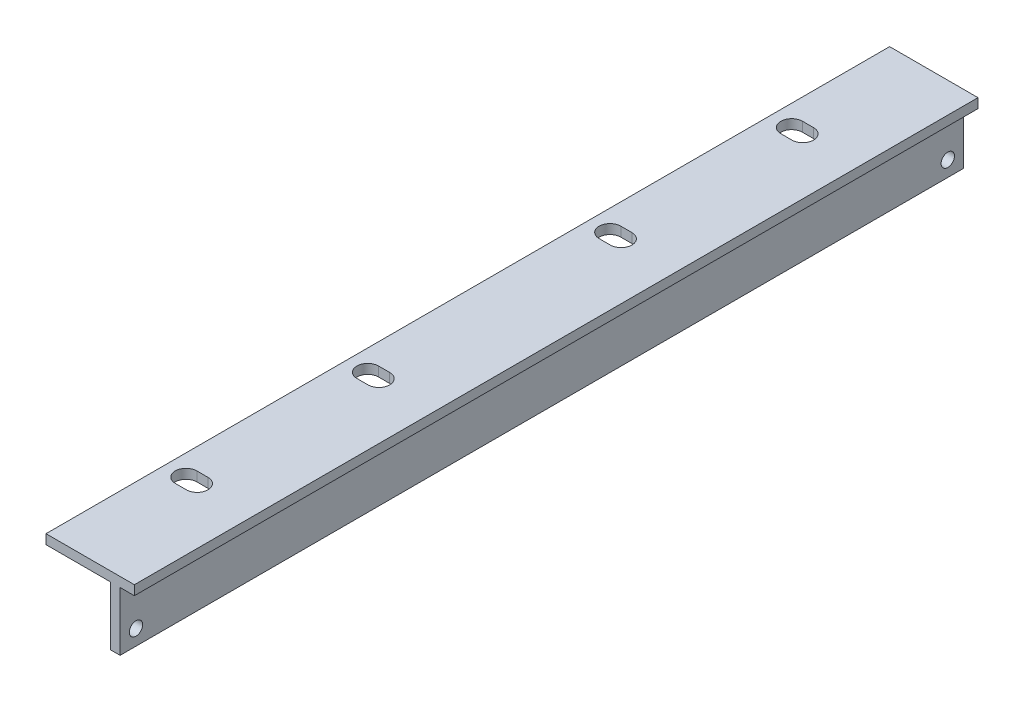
SolidWorks part; units mm, degrees
ref_plane "前视基准面" through (0, 0, 0) normal (0, 0, 1) x (1, 0, 0)
ref_plane "上视基准面" through (0, 0, 0) normal (0, 1, 0) x (1, 0, 0)
ref_plane "右视基准面" through (0, 0, 0) normal (1, 0, 0) x (0, 0, -1)
imported_body "输入1"
sketch "草图1" plane through (0, 0, 0) normal (0, 0, 1) x (1, 0, 0)
  line L0 (-24.8, 0) -> (-27.8, 0)
  line L1 (-27.8, 0) -> (-27.8, -3)
  line L2 (-27.8, -3) -> (-24.8, -3)
  line L8 (-24.8, 0) -> (-24.8, -3)
  line L9 (-24.8, -3) -> (-7.5, -3)
  line L10 (-7.5, -3) -> (-7.5, -21.5)
  line L11 (-7.5, -21.5) -> (-4.5, -21.5)
  line L12 (-4.5, -21.5) -> (-4.5, -3)
  line L13 (-4.5, -3) -> (0, -3)
  line L14 (0, -3) -> (0, 0)
  line L15 (0, 0) -> (-24.8, 0)
  line L17 (-24.8, -3) -> (-7.5, -3)
  line L18 (-7.5, -3) -> (-7.5, -21.5)
  line L19 (-7.5, -21.5) -> (-4.5, -21.5)
  line L20 (-4.5, -21.5) -> (-4.5, -3)
  line L21 (-4.5, -3) -> (0, -3)
  line L22 (0, -3) -> (0, 0)
  line L23 (0, 0) -> (-24.8, 0)
  dimension "D1" = 0
extrude "凸台-拉伸1" add sketch "草图1" along normal blind 265.35
sketch "草图2" plane through (0, 0, 0) normal (0, 1, 0) x (1, 0, 0)
  line L0 (-21.18, -94.575) -> (-17.68, -94.575) construction
  line L1 (-21.18, -91.175) -> (-17.68, -91.175)
  line L2 (-21.18, -97.975) -> (-17.68, -97.975)
  line L3 (-21.18, -170.775) -> (-17.68, -170.775) construction
  line L4 (-21.18, -167.375) -> (-17.68, -167.375)
  line L5 (-21.18, -174.175) -> (-17.68, -174.175)
  line L6 (-27.8, -132.675) -> (28.2462, -132.675) construction
  line L7 (-27.8, -265.35) -> (-27.8, 0) construction
  line L8 (-21.18, -37.425) -> (-17.68, -37.425) construction
  line L9 (-21.18, -34.025) -> (-17.68, -34.025)
  line L10 (-21.18, -40.825) -> (-17.68, -40.825)
  line L11 (0, -265.35) -> (0, 132) construction
  line L12 (-21.18, -227.925) -> (-17.68, -227.925) construction
  line L13 (-21.18, -224.525) -> (-17.68, -224.525)
  line L14 (-21.18, -231.325) -> (-17.68, -231.325)
  arc A0 (-21.18, -91.175) -> (-21.18, -97.975) centre (-21.18, -94.575) ccw
  arc A1 (-17.68, -97.975) -> (-17.68, -91.175) centre (-17.68, -94.575) ccw
  arc A2 (-21.18, -167.375) -> (-21.18, -174.175) centre (-21.18, -170.775) ccw
  arc A3 (-17.68, -174.175) -> (-17.68, -167.375) centre (-17.68, -170.775) ccw
  arc A4 (-21.18, -34.025) -> (-21.18, -40.825) centre (-21.18, -37.425) ccw
  circle A5 centre (-21.18, 94.575) radius 3.4
  arc A6 (-17.68, -40.825) -> (-17.68, -34.025) centre (-17.68, -37.425) ccw
  arc A7 (-21.18, -224.525) -> (-21.18, -231.325) centre (-21.18, -227.925) ccw
  arc A8 (-17.68, -231.325) -> (-17.68, -224.525) centre (-17.68, -227.925) ccw
  point P2 (-19.43, -94.575)
  point P7 (-19.43, -170.775)
  point P20 (-19.43, -227.925)
  point P26 (-19.43, -37.425)
  dimension "D1" = 38.1
  dimension "D2" = 38.1
  dimension "D3" = 3.4
  dimension "D4" = 3.4
  dimension "D5" = 3.5
  dimension "D7" = 17.68
  dimension "D8" = 17.68
  dimension "D6" = 3.5
  dimension "D9" = 2
  dimension "D10" = 2
extrude "切除-拉伸1" cut sketch "草图2" against normal blind 176.45
sketch "草图4" plane through (0, 0, 0) normal (0, 1, 0) x (1, 0, 0)
  line L1 (-36.8731, 135.2948) -> (24.0569, 135.2948)
  line L2 (-36.8731, 135.2948) -> (-36.8731, 0)
  line L3 (-36.8731, 0) -> (24.0569, 0)
  line L4 (24.0569, 135.2948) -> (24.0569, 0)
extrude "切除-拉伸2" cut sketch "草图4" against normal through all
sketch "草图7" plane through (-4.5, 0, 0) normal (1, 0, 0) x (0, 0, -1)
  line L0 (-265.35, -21.5) -> (-265.35, -3) construction
  line L1 (0, -21.5) -> (-265.35, -21.5) construction
  line L2 (-132.675, 0) -> (-132.675, -16.67) construction
  line L3 (-265.35, 0) -> (0, 0) construction
  circle A0 centre (-260.35, -16.67) radius 2.1
  circle A1 centre (-5, -16.67) radius 2.1
  dimension "D1" = 5
  dimension "D2" = 4.83
extrude "切除-拉伸3" cut sketch "草图7" against normal through all
